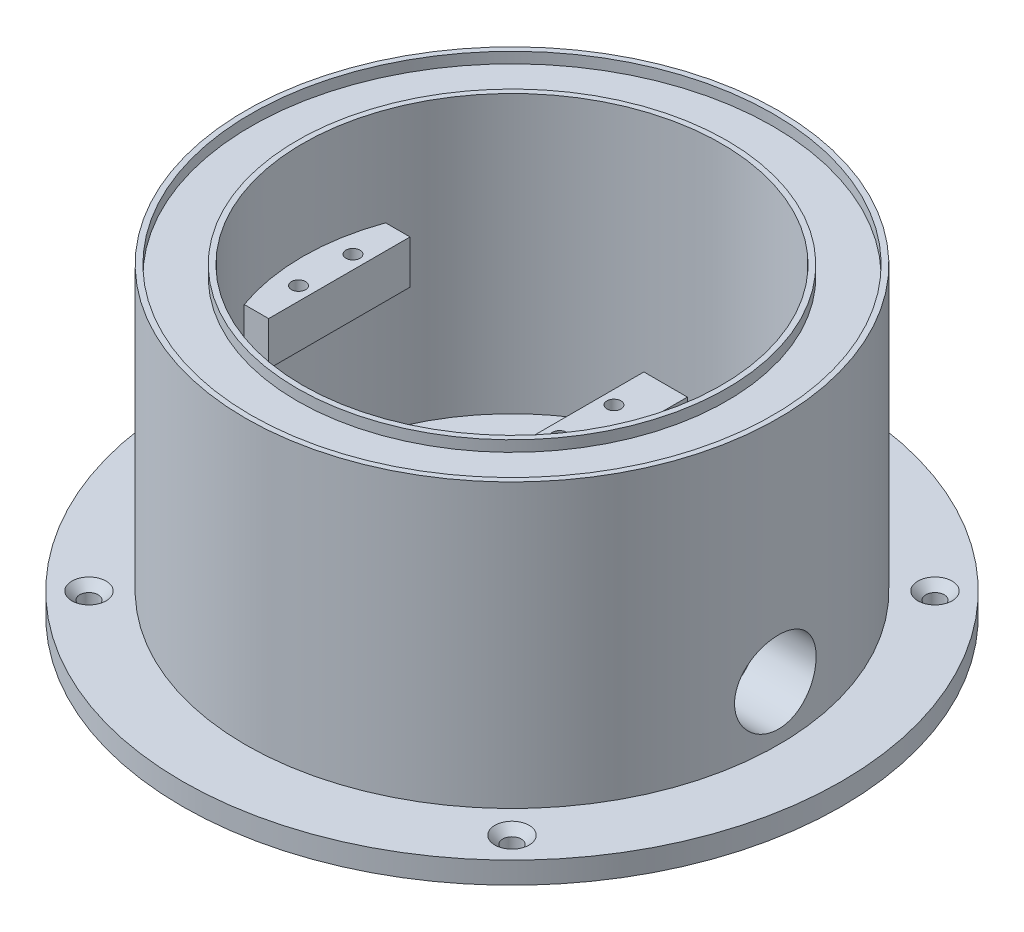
SolidWorks part; units mm, degrees
ref_plane "前视基准面" through (0, 0, 0) normal (0, 0, 1) x (1, 0, 0)
ref_plane "上视基准面" through (0, 0, 0) normal (0, 1, 0) x (1, 0, 0)
ref_plane "右视基准面" through (0, 0, 0) normal (1, 0, 0) x (0, 0, -1)
imported_body "输入1"
other "移动面1" parameters "D1"=1
other "移动面2" parameters "D1"=1
equation "\"Dummy1\"= \"零件图号代码\""
equation "\"Dummy2\"= \"产品名称代码\""
